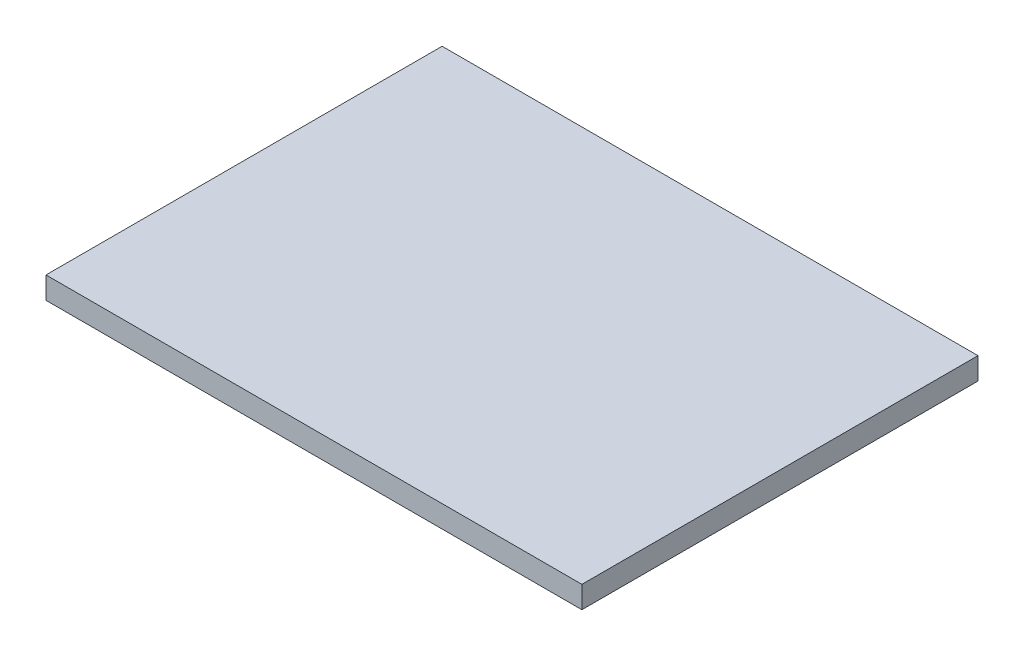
SolidWorks part; units mm, degrees
ref_plane "Plan de face" through (0, 0, 0) normal (0, 0, 1) x (1, 0, 0)
ref_plane "Plan de dessus" through (0, 0, 0) normal (0, 1, 0) x (1, 0, 0)
ref_plane "Plan de droite" through (0, 0, 0) normal (1, 0, 0) x (0, 0, -1)
sketch "Esquisse1" plane through (0, 0, 0) normal (0, 1, 0) x (1, 0, 0)
  line L0 (-14.605, 0) -> (14.605, 0)
  line L2 (-14.605, 0) -> (-14.605, 21.59)
  line L3 (-14.605, 21.59) -> (14.605, 21.59)
  line L4 (14.605, 0) -> (14.605, 21.59)
  dimension "D1" = 29.21
  dimension "D2" = 21.59
extrude "Boss.-Extru.1" add sketch "Esquisse1" along normal blind 1.2
